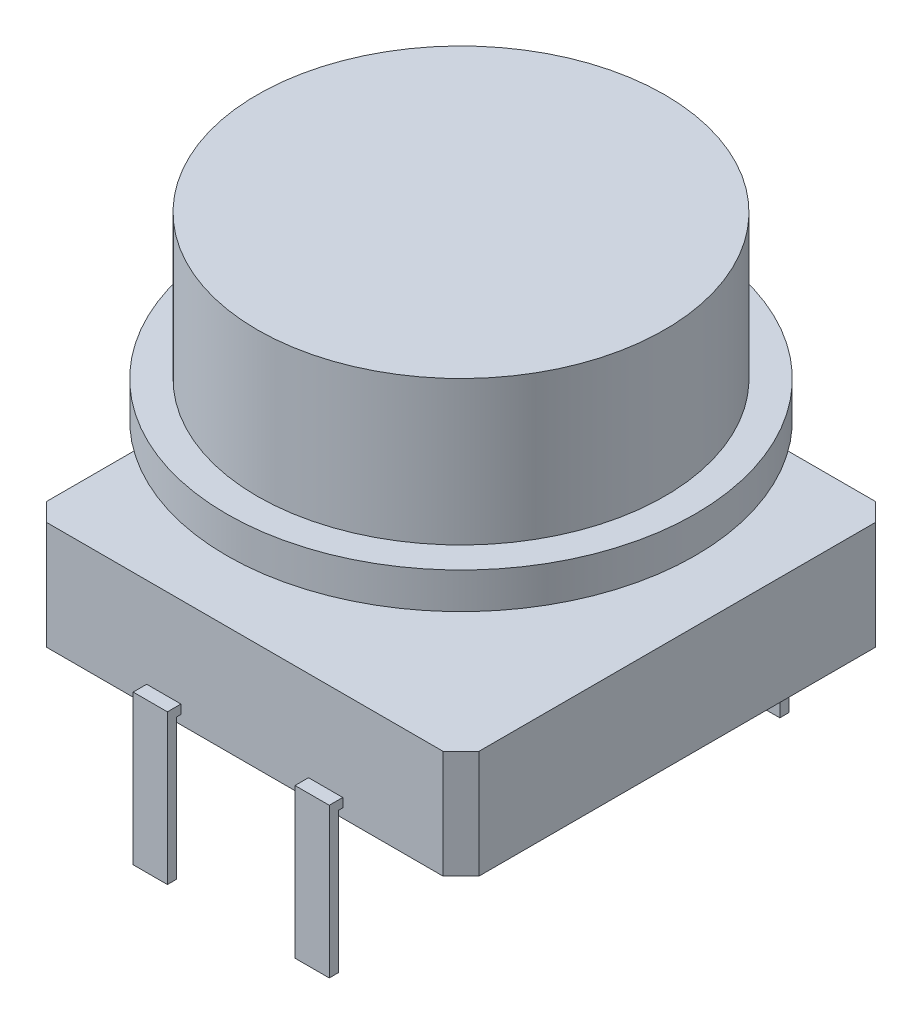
SolidWorks part; units mm, degrees
other "Markup1"
sketch "Sketch13" plane through (-6.5, 10.2, -6.5) normal (-0.9979, 0.0018, -0.0647) x (-0.0647, 0.0089, 0.9979)
ref_plane "Front Plane" through (0, 0, 0) normal (0, 0, 1) x (1, 0, 0)
ref_plane "Top Plane" through (0, 0, 0) normal (0, 1, 0) x (1, 0, 0)
ref_plane "Right Plane" through (0, 0, 0) normal (1, 0, 0) x (0, 0, -1)
sketch "Sketch1" plane through (0, 0, 0) normal (0, 1, 0) x (1, 0, 0)
  line L0 (-5.5, 6) -> (-6, 5.5)
  line L1 (-5.5, 6) -> (5.5, 6)
  line L2 (-6, 5.5) -> (-6, -5.5)
  line L3 (-5.5, -6) -> (5.5, -6)
  line L4 (6, 5.5) -> (6, -5.5)
  line L5 (-6, 6) -> (6, -6) construction
  line L6 (-6, -6) -> (6, 6) construction
  line L7 (5.5, 6) -> (6, 5.5)
  line L8 (5.5, -6) -> (6, -5.5)
  line L9 (-6, -5.5) -> (-5.5, -6)
  point P0 (0, 0)
  dimension "D1" = 12
  dimension "D2" = 12
extrude "Boss-Extrude1" add sketch "Sketch1" along normal blind 3
sketch "Sketch2" plane through (0, 3, 0) normal (0, 1, 0) x (1, 0, 0)
  circle A0 centre (0, 0) radius 3.375
  dimension "D1" = 6.75
extrude "Boss-Extrude2" add sketch "Sketch2" along normal blind 0.2
sketch "Sketch3" plane through (0, 3.2, 0) normal (0, 1, 0) x (1, 0, 0)
  line L1 (-1.75, 1.75) -> (1.75, 1.75)
  line L2 (-1.75, 1.75) -> (-1.75, -1.75)
  line L3 (-1.75, -1.75) -> (1.75, -1.75)
  line L4 (1.75, 1.75) -> (1.75, -1.75)
  line L5 (-1.75, 1.75) -> (1.75, -1.75) construction
  line L6 (-1.75, -1.75) -> (1.75, 1.75) construction
  point P0 (0, 0)
  dimension "D1" = 3.5
  dimension "D2" = 3.5
extrude "Boss-Extrude3" add sketch "Sketch3" along normal blind 2
sketch "Sketch4" plane through (0, 5.2, 0) normal (0, 1, 0) x (1, 0, 0)
  circle A0 centre (0, 0) radius 6.5
  dimension "D1" = 13
extrude "Boss-Extrude4" add sketch "Sketch4" along normal blind 1
sketch "Sketch5" plane through (0, 6.2, 0) normal (0, 1, 0) x (1, 0, 0)
  circle A0 centre (0, 0) radius 5.65
  dimension "D1" = 11.3
extrude "Boss-Extrude5" add sketch "Sketch5" along normal blind 4
ref_plane "Plane1" through (-2.72, 0, 0) normal (-1, 0, 0) x (0, 0, 1)
sketch "Sketch7" plane through (-2.72, 0, 0) normal (-1, 0, 0) x (0, 0, 1)
  line L1 (6, 3) -> (6, 0) construction
  line L7 (6.375, 0.5) -> (6, 0.5)
  line L9 (-5.5, 3) -> (5.5, 3) construction
  line L17 (0, -2.34) -> (0, 11.1182) construction
  line L18 (6, 0.5) -> (6, 0.25)
  line L23 (6.1875, 0.5) -> (6.1875, -2.75) construction
  line L24 (6, 0.25) -> (6.125, 0.25)
  line L28 (6.125, 0.25) -> (6.125, -3.65)
  line L29 (6.375, 0.5) -> (6.375, -3.65)
  line L30 (6.375, -3.65) -> (6.125, -3.65)
  dimension "D1" = 2.5
  dimension "D2" = 0.375
  dimension "D6" = 0.25
extrude "Boss-Extrude6" add sketch "Sketch7" against normal blind 0.95
ref_plane "Plane2" through (0, 0, 0) normal (-1, 0, 0) x (0, 0, 1)
mirror "Mirror1" about plane through (0, 0, 0) normal (-1, 0, 0) of "Boss-Extrude6"
ref_plane "Plane3" through (0, 0, 0) normal (0, 0, 1) x (1, 0, 0)
mirror "Mirror2" about plane through (0, 0, 0) normal (0, 0, 1) of "Mirror1", "Boss-Extrude6"
